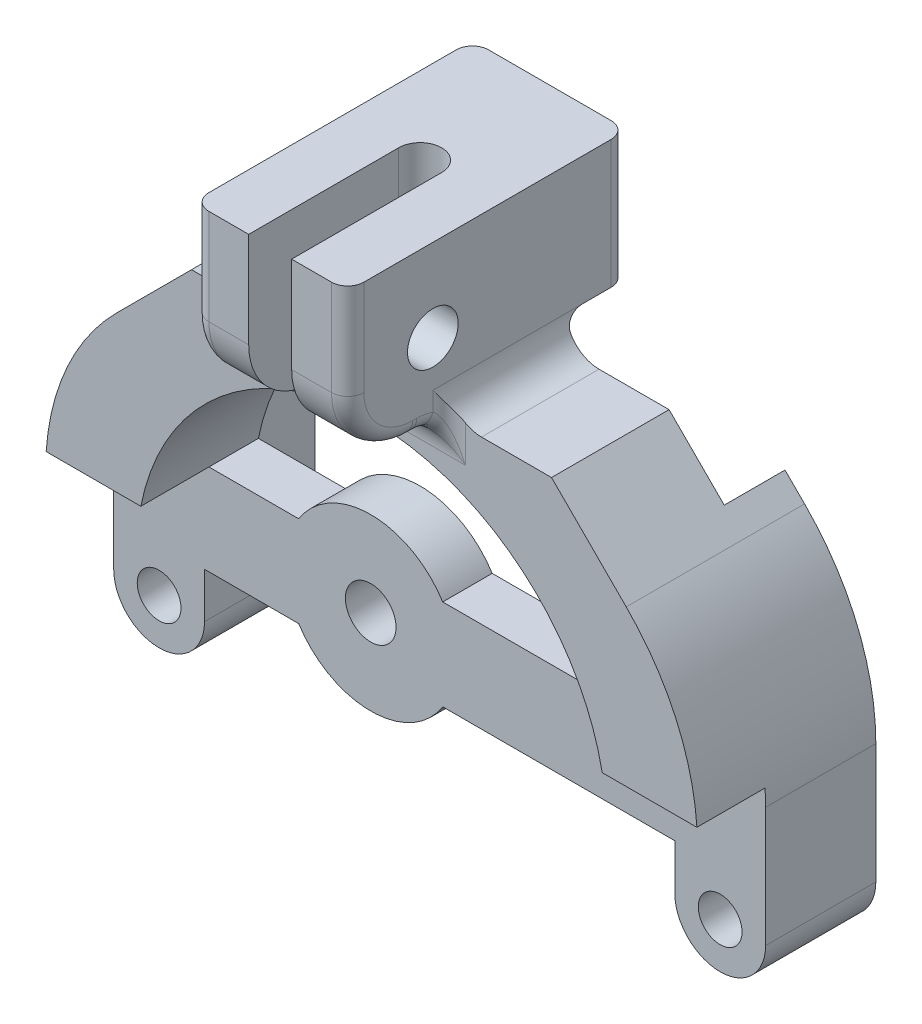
SolidWorks part; units mm, degrees
ref_plane "Front Plane" through (0, 0, 0) normal (0, 0, 1) x (1, 0, 0)
ref_plane "Top Plane" through (0, 0, 0) normal (0, 1, 0) x (1, 0, 0)
ref_plane "Right Plane" through (0, 0, 0) normal (1, 0, 0) x (0, 0, -1)
sketch "Sketch1" plane through (0, 0, 0) normal (0, 0, 1) x (1, 0, 0)
  line L0 (0, 0) -> (0, -52.1) construction
  line L1 (-17.3, 0) -> (17.3, 0) construction
  line L2 (-17.3, -9.6) -> (17.3, -9.6) construction
  line L3 (17.3, -9.6) -> (17.3, 0) construction
  line L4 (14.5, -9.6) -> (14.5, -4)
  line L5 (20.1, -9.6) -> (20.1, 13)
  line L6 (-17.3, -9.6) -> (-17.3, 0) construction
  line L7 (-20.1, -9.6) -> (-20.1, 13)
  line L8 (-14.5, -9.6) -> (-14.5, -4)
  line L9 (-17.3, 0) -> (-17.3, 9) construction
  line L10 (-20.1, 13) -> (20.1, 13)
  line L11 (-17.3, 9) -> (17.9065, 9) construction
  line L12 (3.3541, 9) -> (-3.3541, 9)
  line L13 (0, -4) -> (0, 21) construction
  circle A1 centre (17.3, -9.6) radius 1.35
  arc A2 (14.5, -9.6) -> (20.1, -9.6) centre (17.3, -9.6) ccw
  arc A3 (14.5, -4) -> (10.8077, 5.6667) centre (0, -4) ccw
  arc A4 (-10.8077, 5.6667) -> (-14.5, -4) centre (0, -4) ccw
  arc A5 (-14.5, -9.6) -> (-20.1, -9.6) centre (-17.3, -9.6) cw
  circle A6 centre (-17.3, -9.6) radius 1.35
  arc A8 (-3.3541, 9) -> (-10.8077, 5.6667) centre (-3.3541, -1) ccw
  arc A9 (3.3541, 9) -> (10.8077, 5.6667) centre (3.3541, -1) cw
  point P16 (0, -9.6)
  point P20 (0, -4)
  point P28 (-6.4226, 9)
  point P31 (6.4226, 9)
  dimension "D4" = 2.7
  dimension "D6" = 10
  dimension "D1" = 17.3
  dimension "D3" = 9.6
  dimension "D5" = 2.8
  dimension "D7" = 4
  dimension "D8" = 9
  dimension "D9" = 4
  dimension "D10" = 48.1
  dimension "D11" = 25
extrude "Boss-Extrude1" add sketch "Sketch1" along normal mid plane 11
sketch "Sketch5" plane through (0, 0, -5.5) normal (0, 0, -1) x (-1, 0, 0)
  line L0 (0, 0) -> (0, 13) construction
  line L1 (20.1, 13) -> (-20.1, 13) construction
  line L2 (-14.5, -4) -> (-14.5, 14.9)
  line L3 (-14.5, 14.9) -> (14.5, 14.9)
  line L4 (-14.5, -4) -> (14.5, -4)
  line L5 (14.5, -4) -> (14.5, 14.9)
  point P13 (0, -4)
  point P14 (0, 14.9)
  dimension "D2" = 14.9
extrude "Cut-Extrude3" cut sketch "Sketch5" against normal blind 3.75
sketch "Sketch6" plane through (0, 13, 0) normal (0, 1, 0) x (1, 0, 0)
  line L0 (-17.8, -2.5) -> (17.8, -2.5) construction
  line L1 (-1.325, -2.5) -> (-1.325, -5.5)
  line L2 (-20.1, -5.5) -> (20.1, -5.5) construction
  line L3 (-20.1, 5.5) -> (-14.5, 5.5) construction
  line L4 (-1.325, -5.5) -> (1.325, -5.5)
  line L5 (1.325, -5.5) -> (1.325, -2.5)
  line L6 (0, 0) -> (0, -2.5) construction
  arc A0 (1.325, -2.5) -> (-1.325, -2.5) centre (0, -2.5) ccw
  dimension "D1" = 2.65
  dimension "D2" = 8
extrude "Cut-Extrude4" cut sketch "Sketch6" against normal through all
sketch "Sketch17" plane through (0, 13, 0) normal (0, 1, 0) x (1, 0, 0)
  line L0 (1.325, 5.5) -> (1.325, -11.75)
  line L1 (-20.1, 5.5) -> (-14.5, 5.5) construction
  line L2 (4.78, 5.5) -> (4.78, -11.75)
  line L3 (1.325, -11.75) -> (4.78, -11.75)
  line L4 (1.325, -5.5) -> (20.1, -5.5) construction
  line L5 (1.325, -5.5) -> (1.325, -2.5) construction
  line L6 (-1.325, -11.75) -> (-4.78, -11.75)
  line L7 (-4.78, 5.5) -> (-4.78, -11.75)
  line L8 (-1.325, 5.5) -> (-1.325, -11.75)
  line L9 (-4.78, 5.5) -> (-1.325, 5.5)
  line L10 (1.325, 5.5) -> (4.78, 5.5)
  line L11 (0, 1.75) -> (0, -1.175) construction
  line L12 (14.5, 1.75) -> (-14.5, 1.75) construction
  arc A0 (1.325, -2.5) -> (-1.325, -2.5) centre (0, -2.5) ccw construction
  point P2 (0, 0)
  dimension "D1" = 6.25
  dimension "D2" = 4.78
extrude "Boss-Extrude10" add sketch "Sketch17" along normal blind 9.9
sketch "Sketch18" plane through (-4.78, 0, 0) normal (-1, 0, 0) x (0, 0, 1)
  line L2 (-1.75, 13) -> (5.5, 13) construction
  line L3 (-5.5, 22.9) -> (-5.5, 13) construction
  line L4 (5.5, 13) -> (11.75, 13) construction
  circle A0 centre (6.5, 17.8) radius 1.5625
  point P0 (6.5, 17.8)
  point P1 (2.5, 17.8)
  dimension "D5" = 3.125
  dimension "D1" = 8
  dimension "D2" = 4
  dimension "D3" = 4.8
  dimension "D4" = 4.8
extrude "Cut-Extrude9" cut sketch "Sketch18" against normal through all
fillet "Fillet10" radius 2 2 edges at (-3.0525, 13, 5.5)
fillet "Fillet11" radius 4 2 edges at (3.0525, 13, 11.75) (-3.0525, 13, 11.75)
sketch "Sketch19" plane through (0, 0, 5.5) normal (0, 0, 1) x (1, 0, 0)
  line L0 (0, 0) -> (0, -4) construction
  line L1 (-14.5, -4) -> (-14.5, -15.8685)
  line L2 (-14.5, -15.8685) -> (14.5, -15.8685)
  line L3 (14.5, -15.8685) -> (14.5, -4)
  arc A0 (14.5, -4) -> (-14.5, -4) centre (0, -4) ccw
  dimension "D1" = 4
extrude "Cut-Extrude10" cut sketch "Sketch19" against normal blind 7.5
fillet "Fillet13" radius 1 2 edges at (4.78, 12, 5.5) (-4.78, 12, 5.5)
chamfer "Chamfer1" distance 9 angle 45 2 edges at (20.1, 13, 0) (-20.1, 13, 0)
sketch "Sketch24" plane through (-4.78, 0, 0) normal (-1, 0, 0) x (0, 0, 1)
  line L1 (-5.5, 15) -> (-1.75, 15)
  line L2 (-5.5, 22.9) -> (-5.5, 13) construction
  line L3 (-1.75, 15) -> (-1.75, 13)
  line L4 (-5.5, 15) -> (-5.5, 13)
  line L6 (-5.5, 13) -> (-1.75, 13)
  line L7 (-1.75, 13) -> (6.5, 13) construction
  dimension "D1" = 2
  dimension "D2" = 3.75
extrude "Cut-Extrude12" cut sketch "Sketch24" against normal up to surface (9.56 mm away)
fillet "Fillet15" radius 2 2 edges at (-4.78, 13, 2.375) (4.78, 13, 2.375)
fillet "Fillet16" radius 15 2 edges at (20.1, 4, 0) (-20.1, 4, 0)
sketch "Sketch25" plane through (0, 13, 0) normal (0, 1, 0) x (1, 0, 0)
  line L0 (-1.325, 5.5) -> (-4.78, 5.5) construction
  line L1 (1.325, 1.75) -> (1.325, -2.5) construction
  line L2 (-1.325, -2.5) -> (-1.325, 1.75) construction
  line L3 (1.325, 1.75) -> (1.325, 5.5)
  line L4 (1.325, 1.75) -> (1.325, -2.5)
  line L5 (-1.325, -2.5) -> (-1.325, 1.75)
  line L6 (1.325, 5.5) -> (-1.325, 5.5)
  line L7 (-1.325, 5.5) -> (-1.325, 1.75)
  arc A0 (1.325, -2.5) -> (-1.325, -2.5) centre (0, -2.5) ccw construction
  arc A1 (1.325, -2.5) -> (-1.325, -2.5) centre (0, -2.5) ccw
extrude "Boss-Extrude11" add sketch "Sketch25" along normal up to surface (9.9 mm away)
fillet "Fillet14" radius 1 2 edges at (3.0525, 15, -1.75) (-3.0525, 15, -1.75)
sketch "Sketch26" plane through (1.325, 0, 0) normal (1, 0, 0) x (0, 0, -1)
  line L0 (1.75, 13) -> (5.5, 13) construction
  line L1 (5.5, 15) -> (5.5, 13) construction
  line L2 (5.5, 15) -> (2.75, 15) construction
  line L3 (1.75, 14) -> (1.75, 13) construction
  line L4 (1.75, 13) -> (5.5, 13)
  line L5 (5.5, 15) -> (5.5, 13)
  line L6 (5.5, 15) -> (2.75, 15)
  line L7 (1.75, 14) -> (1.75, 13)
  arc A0 (2.75, 15) -> (1.75, 14) centre (2.75, 14) ccw construction
  arc A1 (2.75, 15) -> (1.75, 14) centre (2.75, 14) ccw
extrude "Cut-Extrude13" cut sketch "Sketch26" against normal through all
fillet "Fillet17" radius 1 12 edges at (5.1074, 11.9861, 5.76) (4.78, 12.9319, 6.9824) (4.78, 13, 7.625) (4.78, 14.1716, 10.5784) (-4.78, 19.95, 11.75) (4.78, 19.95, 11.75) (-4.78, 18.95, -5.5) (4.78, 18.95, -5.5) (-5.1074, 11.9861, 5.76) (-4.78, 12.9319, 6.9824) (-4.78, 13, 7.625) (-4.78, 14.1716, 10.5784)
sketch "Sketch27" plane through (0, 0, 5.5) normal (0, 0, 1) x (1, 0, 0)
  line L0 (-14.5, -4) -> (14.5, -4) construction
  line L1 (0, -4) -> (0, -13.1864) construction
  line L3 (-14.5, -9.6) -> (-14.5, -4) construction
  line L4 (-14.5, -6.8) -> (14.5, -6.8)
  line L5 (-14.5, -6.8) -> (-14.5, -1.2)
  line L6 (-14.5, -1.2) -> (14.5, -1.2)
  line L7 (14.5, -6.8) -> (14.5, -1.2)
  circle A0 centre (-4.25, -4) radius 1.5625
  point P4 (0, -4)
  point P5 (-4.25, -4)
  dimension "D2" = 3.125
  dimension "D1" = 4.25
extrude "Boss-Extrude12" add sketch "Sketch27" against normal up to surface (7.25 mm away)
sketch "Sketch28" plane through (0, 0, 5.5) normal (0, 0, 1) x (1, 0, 0)
  line L0 (0, -1.2) -> (0, -6.8) construction
  line L1 (14.2271, -1.2) -> (-14.2271, -1.2) construction
  line L2 (-14.5, -6.8) -> (14.5, -6.8) construction
  line L3 (0, -4) -> (-20.1, -4) construction
  line L4 (-20.1, -9.6) -> (-20.1, -2.2132) construction
  line L5 (-14.5, -4) -> (-14.5, -6.8)
  line L6 (14.2271, -1.2) -> (-14.2271, -1.2)
  line L7 (-14.5, -6.8) -> (14.5, -6.8)
  line L8 (14.5, -4) -> (14.5, -6.8)
  arc A0 (-14.2271, -1.2) -> (-14.5, -4) centre (0, -4) ccw
  arc A1 (14.2271, -1.2) -> (14.5, -4) centre (0, -4) cw
extrude "Cut-Extrude14" cut sketch "Sketch28" against normal offset from surface (4.2 mm away) 3.05
sketch "Sketch29" plane through (0, 0, 5.5) normal (0, 0, 1) x (1, 0, 0)
  line L0 (-20.1, -9.6) -> (-20.1, -2.2132) construction
  line L1 (-20.1, -1.2) -> (20.1, -1.2)
  line L2 (-20.1, -1.2) -> (-20.1, -13.898)
  line L3 (-20.1, -13.898) -> (20.1, -13.898)
  line L4 (20.1, -1.2) -> (20.1, -13.898)
  line L5 (20.1, -9.6) -> (20.1, -2.2132) construction
  line L6 (14.2271, -1.2) -> (-14.2271, -1.2) construction
extrude "Cut-Extrude15" cut sketch "Sketch29" against normal up to surface (4.2 mm away)
sketch "Sketch30" plane through (0, 0, 1.3) normal (0, 0, 1) x (1, 0, 0)
  circle A0 centre (-4.25, -4) radius 1.5625
  circle A1 centre (-4.25, -4) radius 5.25
  dimension "D1" = 10.5
extrude "Boss-Extrude13" add sketch "Sketch30" against normal up to surface (3.05 mm away)
equation "\"D1@Sketch6\"=\"pulley thickness@values@params.sldprt\"+0.25"
